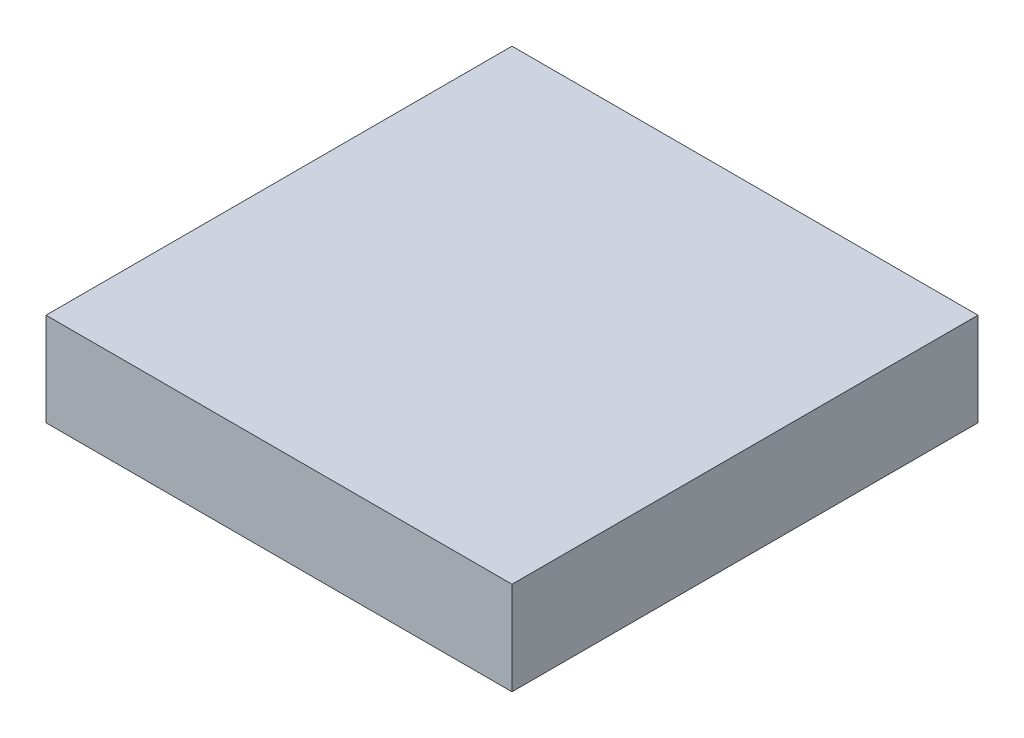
SolidWorks part; units mm, degrees
ref_plane "Front Plane" through (0, 0, 0) normal (0, 0, 1) x (1, 0, 0)
ref_plane "Top Plane" through (0, 0, 0) normal (0, 1, 0) x (1, 0, 0)
ref_plane "Right Plane" through (0, 0, 0) normal (1, 0, 0) x (0, 0, -1)
sketch "Sketch1" plane through (0, 0, 0) normal (0, 1, 0) x (1, 0, 0)
  line L1 (-75, -75) -> (75, -75)
  line L2 (-75, -75) -> (-75, 75)
  line L3 (-75, 75) -> (75, 75)
  line L4 (75, -75) -> (75, 75)
  line L5 (-75, -75) -> (75, 75) construction
  line L6 (-75, 75) -> (75, -75) construction
  point P0 (0, 0)
  dimension "D1" = 150
  dimension "D2" = 150
extrude "Boss-Extrude1" add sketch "Sketch1" along normal blind 30
sketch "Sketch2" plane through (0, 30, 0) normal (0, 1, 0) x (1, 0, 0)
  line L0 (-50, -75) -> (-50, 0)
  line L2 (50, -75) -> (50, 0)
  line L3 (-75, -75) -> (75, -75) construction
  line L5 (-75, 75) -> (-75, -75) construction
  arc A0 (50, 0) -> (-50, 0) centre (0, 0) ccw
  point P7 (50, -75)
  dimension "D1" = 50
  dimension "D2" = 75
  dimension "D3" = 25
sketch "Sketch3" plane through (0, 0, 75) normal (0, 0, 1) x (1, 0, 0)
  line L2 (-63.5, 30) -> (-36.5, 30)
  line L3 (50, 30) -> (-50, 30) construction
  arc A0 (-36.5, 30) -> (-63.5, 30) centre (-50, 30) cw
  dimension "D1" = 13.5
